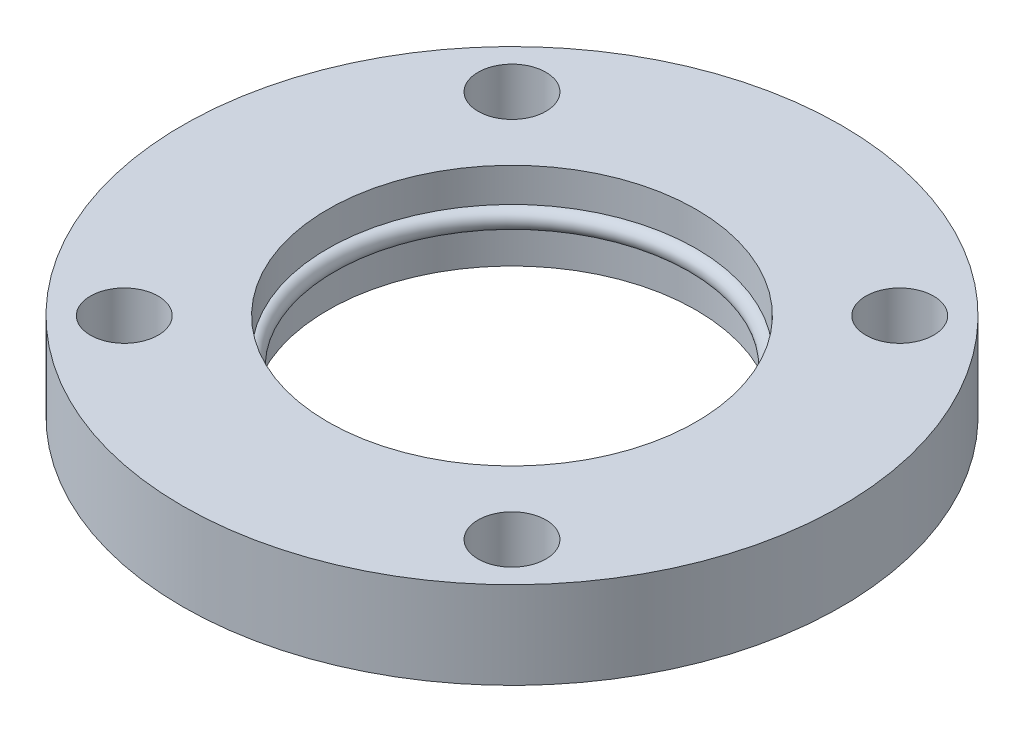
SolidWorks part; units mm, degrees
ref_plane "Front Plane" through (0, 0, 0) normal (0, 0, 1) x (1, 0, 0)
ref_plane "Top Plane" through (0, 0, 0) normal (0, 1, 0) x (1, 0, 0)
ref_plane "Right Plane" through (0, 0, 0) normal (1, 0, 0) x (0, 0, -1)
sketch "Sketch2" plane through (0, 0, 0) normal (0, 1, 0) x (1, 0, 0)
  line L1 (-20, -20) -> (20, -20) construction
  line L2 (-20, -20) -> (-20, 20) construction
  line L3 (-20, 20) -> (20, 20) construction
  line L4 (20, -20) -> (20, 20) construction
  line L5 (-20, -20) -> (20, 20) construction
  line L6 (-20, 20) -> (20, -20) construction
  circle A0 centre (0, 0) radius 19
  circle A1 centre (0, 0) radius 34
  circle A2 centre (-20, 20) radius 3.5
  circle A3 centre (20, 20) radius 3.5
  circle A4 centre (20, -20) radius 3.5
  circle A5 centre (-20, -20) radius 3.5
  dimension "D1" = 68
  dimension "D2" = 38
  dimension "D4" = 7
  dimension "D3" = 40
extrude "Boss-Extrude1" add sketch "Sketch2" along normal mid plane 9
sketch "Sketch3" plane through (0, 0, 0) normal (0, 0, 1) x (1, 0, 0)
  line L0 (-19, 0) -> (0, 0) construction
  line L1 (0, 0) -> (0, 4.5) construction
  line L2 (34, 4.5) -> (-34, 4.5) construction
  circle A0 centre (-19, 0) radius 1
  dimension "D1" = 2
  dimension "D2" = 38
revolve "Revolve2" add sketch "Sketch3" angle 360 about L1
